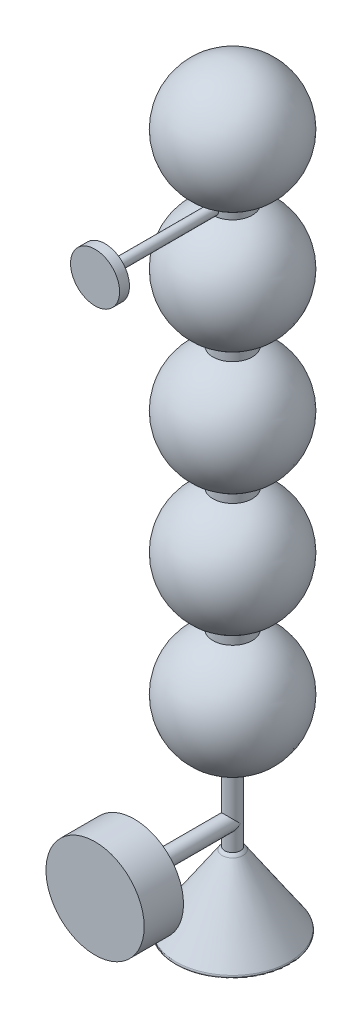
SolidWorks part; units mm, degrees
ref_plane "Alzado" through (0, 0, 0) normal (0, 0, 1) x (1, 0, 0)
ref_plane "Planta" through (0, 0, 0) normal (0, 1, 0) x (1, 0, 0)
ref_plane "Vista lateral" through (0, 0, 0) normal (1, 0, 0) x (0, 0, -1)
sketch "Croquis2" plane through (0, 0, 0) normal (0, 1, 0) x (1, 0, 0)
  circle A0 centre (0, 0) radius 8
  dimension "D1" = 16
extrude "Saliente-Extruir2" add sketch "Croquis2" along normal blind 150 separate body
sketch "Croquis3" plane through (0, 0, 0) normal (0, 0, 1) x (1, 0, 0)
  line L0 (0, 1237.2468) -> (0, 0) construction
  line L2 (0, 150) -> (0, 270)
  line L3 (8, 150) -> (-8, 150) construction
  arc A0 (0, 150) -> (0, 270) centre (0, 210) cw
  dimension "D1" = 60
revolve "Revolución1" add sketch "Croquis3" angle 360 about L0
sketch "Croquis6" plane through (0, 0, 0) normal (0, 0, 1) x (1, 0, 0)
  line L0 (0, 253.6138) -> (0, 277.2982) construction
  line L1 (0, 267.2982) -> (0, 277.2982)
  line L2 (0, 267.2982) -> (-20, 267.2982)
  line L4 (0, 277.2982) -> (-20, 277.2982)
  line L5 (-20, 267.2982) -> (-20, 277.2982)
  dimension "D1" = 10
  dimension "D2" = 20
revolve "Revolución3" add sketch "Croquis6" angle 360 about L0
pattern_linear "MatrizL1" count 4 spacing 125 along (0, 1, 0)
sketch "Croquis7" plane through (0, 0, 0) normal (0, 0, 1) x (1, 0, 0)
  line L0 (0, 648.1493) -> (0, 768.1493) construction
  line L2 (0, 648.1493) -> (0, 768.1493)
  arc A0 (0, 648.1493) -> (0, 768.1493) centre (0, 708.1493) cw
  dimension "D1" = 120
revolve "Revolución4" add sketch "Croquis7" angle 360 about L0
sketch "Croquis8" plane through (0, 0, 0) normal (0, 0, 1) x (1, 0, 0)
  line L0 (0, 0) -> (0, 100) construction
  circle A0 centre (0, 100) radius 8
  dimension "D2" = 16
  dimension "D1" = 100
extrude "Saliente-Extruir3" add sketch "Croquis8" along normal blind 100
sketch "Croquis9" plane through (0, 0, 100) normal (0, 0, 1) x (1, 0, 0)
  circle A0 centre (0, 100) radius 50
  dimension "D1" = 100
extrude "Saliente-Extruir4" add sketch "Croquis9" along normal blind 40 separate body
sketch "Croquis10" plane through (0, 0, 0) normal (0, 0, 1) x (1, 0, 0)
  circle A0 centre (0, 647.3522) radius 5
  dimension "D2" = 10
extrude "Saliente-Extruir5" add sketch "Croquis10" along normal blind 130
sketch "Croquis11" plane through (0, 0, 130) normal (0, 0, 1) x (1, 0, 0)
  circle A0 centre (0, 647.3522) radius 25
  dimension "D1" = 50
extrude "Saliente-Extruir6" add sketch "Croquis11" along normal blind 10 separate body
sketch "Croquis5" plane through (0, 0, 0) normal (0, 0, 1) x (1, 0, 0)
  line L0 (0, 0) -> (0, 80) construction
  line L1 (0, 0) -> (-60, 0)
  line L2 (-60, 0) -> (-10.6517, 73.1619)
  line L3 (0, 0) -> (0, 80)
  arc A1 (-10.6517, 73.1619) -> (0, 80) centre (2.6129, 64.2148) cw
  circle A2 centre (0, 585) radius 60 construction
  point P2 (60, 585)
  dimension "D2" = 80
  dimension "D3" = 16
  dimension "D1" = 60
  dimension "D4" = 56
revolve "Revolución2" add sketch "Croquis5" angle 360 about L0
fillet "Redondeo2" radius 2 1 edges at (0, 0, -60)
ref_plane "Plano1" through (0, -500, 0) normal (0, -1, 0) x (-1, 0, 0)
